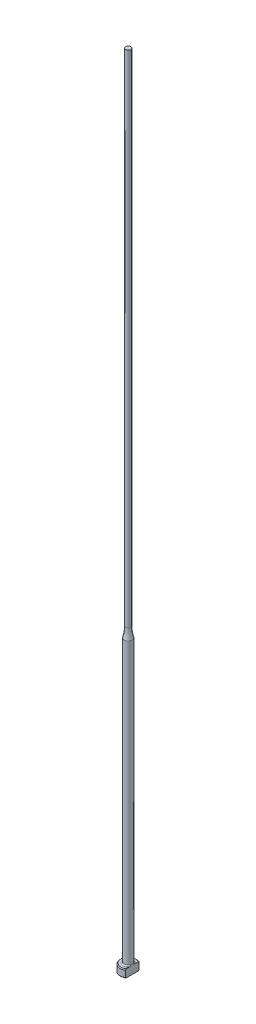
SolidWorks part; units mm, degrees
ref_plane "Front Plane" through (0, 0, 0) normal (0, 0, 1) x (1, 0, 0)
ref_plane "Top Plane" through (0, 0, 0) normal (0, 1, 0) x (1, 0, 0)
ref_plane "Right Plane" through (0, 0, 0) normal (1, 0, 0) x (0, 0, -1)
sketch "Sketch1" plane through (0, 0, 0) normal (0, 0, 1) x (1, 0, 0)
  line L0 (0, 259.9588) -> (0, -15.1925) construction
  line L1 (0, 0) -> (-2, 0)
  line L2 (-2, 0) -> (-2, 2)
  line L3 (-2, 2) -> (-1, 2)
  line L4 (-0.65, 75) -> (-0.65, 200)
  line L5 (-0.65, 200) -> (0, 200)
  line L6 (0, 200) -> (0, 0)
  line L7 (-1, 2) -> (-1, 72.3775)
  arc A0 (-1, 72.3775) -> (-0.65, 75) centre (-10.65, 75) ccw
  point P13 (-1, 0)
  dimension "D1" = 10
  dimension "L" = 200
  dimension "H" = 4
  dimension "T" = 2
  dimension "D" = 1.3
  dimension "B" = 2
  dimension "S" = 75
revolve "Revolve1" add sketch "Sketch1" angle 360 about L0
chamfer "Chamfer1" distance 0.2 angle 45 2 edges at (0, 2, 2) (0, 0, 2)
fillet "Fillet1" radius 0.3 1 edges at (0, 2, 1)
sketch "Sketch2" plane through (0, 0, 0) normal (0, 1, 0) x (1, 0, 0)
  line L0 (1, 1.7321) -> (1, -1.7321)
  circle A0 centre (0, 0) radius 2 construction
  arc A1 (1, -1.7321) -> (1, 1.7321) centre (0, 0) ccw
  circle A2 centre (0, 0) radius 1 construction
extrude "KEY" cut sketch "Sketch2" along normal through all
